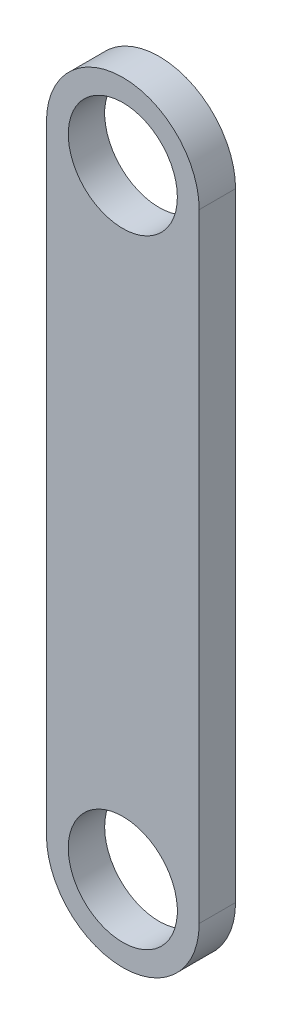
SolidWorks part; units mm, degrees
ref_plane "Front Plane" through (0, 0, 0) normal (0, 0, 1) x (1, 0, 0)
ref_plane "Top Plane" through (0, 0, 0) normal (0, 1, 0) x (1, 0, 0)
ref_plane "Right Plane" through (0, 0, 0) normal (1, 0, 0) x (0, 0, -1)
sketch "Sketch_Swinging Arm" plane through (0, 0, 0) normal (0, 0, 1) x (1, 0, 0)
  line L0 (-10.5, 42.5) -> (-10.5, -42.5)
  line L1 (10.5, 42.5) -> (10.5, -42.5)
  line L2 (10.5, 0) -> (-10.5, 0) construction
  circle A0 centre (0, 42.5) radius 7.5
  arc A1 (10.5, 42.5) -> (-10.5, 42.5) centre (0, 42.5) ccw
  arc A2 (10.5, -42.5) -> (-10.5, -42.5) centre (0, -42.5) cw
  circle A3 centre (0, 42.5) radius 10.5 construction
  circle A4 centre (0, -42.5) radius 7.5
  point P9 (10.5, 0)
extrude "Swinging Arm" add sketch "Sketch_Swinging Arm" against normal blind 5
equation "\"D3@Sketch_Swinging Arm\"=85"
